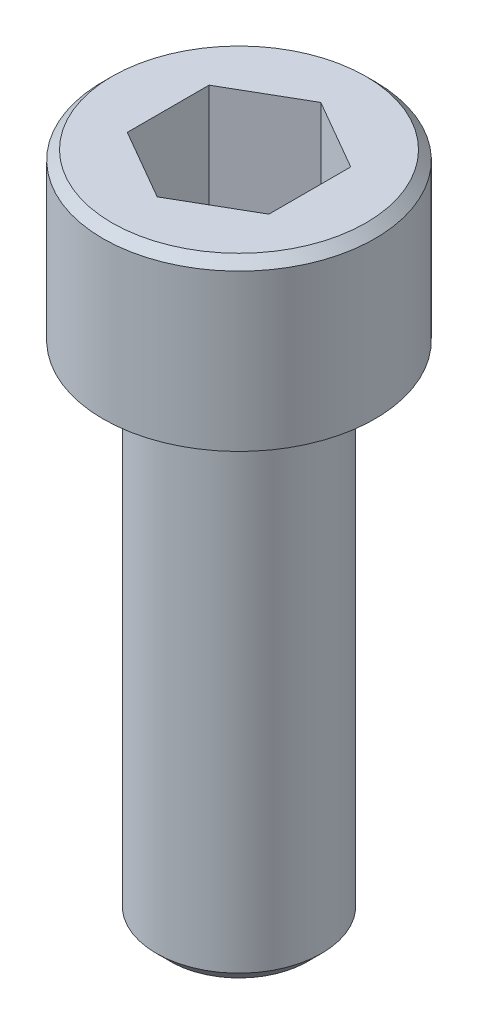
SolidWorks part; units mm, degrees
ref_plane "Front" through (0, 0, 0) normal (0, 0, 1) x (1, 0, 0)
ref_plane "Top" through (0, 0, 0) normal (0, 1, 0) x (1, 0, 0)
ref_plane "Right" through (0, 0, 0) normal (1, 0, 0) x (0, 0, -1)
sketch "Sketch1" plane through (0, 0, 0) normal (0, 1, 0) x (1, 0, 0)
  circle A0 centre (0, 0) radius 3.429
  dimension "D1" = 6.858
extrude "Head" add sketch "Sketch1" along normal blind 4.1656
sketch "Sketch2" plane through (0, 0, 0) normal (0, -1, 0) x (1, 0, 0)
  circle A0 centre (0, 0) radius 2.0828
  dimension "D1" = 4.1656
extrude "Shank" add sketch "Sketch2" along normal blind 12.7
sketch "Sketch3" plane through (0, 4.1656, 0) normal (0, 1, 0) x (-1, 0, 0)
  line L0 (0, -2.0622) -> (0, 2.0622) construction
  line L1 (0, 2.0622) -> (-1.7859, 1.0311)
  line L2 (-1.7859, 1.0311) -> (-1.7859, -1.0311)
  line L3 (-1.7859, -1.0311) -> (0, -2.0622)
  line L4 (0, 2.0622) -> (1.7859, 1.0311)
  line L5 (1.7859, 1.0311) -> (1.7859, -1.0311)
  line L6 (1.7859, -1.0311) -> (0, -2.0622)
  dimension "D1" = 120
  dimension "D2" = 3.5719
extrude "Hex" cut sketch "Sketch3" against normal blind 3.9116
chamfer "Head Chamfer" distance 0.2286 angle 45 1 edges at (0, 4.1656, 3.429)
chamfer "Thread Chamfer" distance 0.3556 angle 45 1 edges at (0, -12.7, -2.0828)
sketch "Sketch4" plane through (0, -12.7, 0) normal (0, -1, 0) x (1, 0, 0)
  circle A0 centre (0, 0) radius 0.762
  dimension "D1" = 1.524
extrude "Cut-Extrude1" cut sketch "Sketch4" against normal through all
